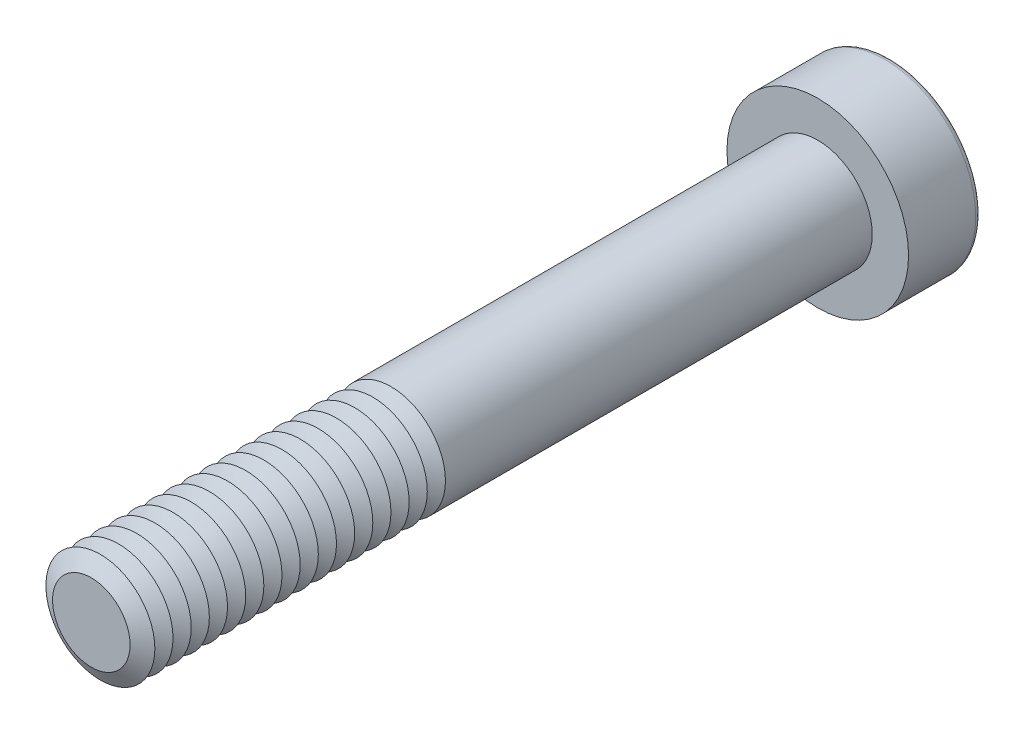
SolidWorks part; units mm, degrees
ref_plane "Front Plane" through (0, 0, 0) normal (0, 0, 1) x (1, 0, 0)
ref_plane "Top Plane" through (0, 0, 0) normal (0, 1, 0) x (1, 0, 0)
ref_plane "Right Plane" through (0, 0, 0) normal (1, 0, 0) x (0, 0, -1)
sketch "Sketch1" plane through (0, 0, 0) normal (0, 0, 1) x (1, 0, 0)
  circle A0 centre (0, 0) radius 3
  dimension "D1" = 6
extrude "Boss-Extrude1" add sketch "Sketch1" along normal blind 40
sketch "Sketch2" plane through (0, 0, 0) normal (0, 0, -1) x (-1, 0, 0)
  circle A0 centre (0, 0) radius 5
  dimension "D1" = 10
extrude "Boss-Extrude2" add sketch "Sketch2" along normal blind 4
sketch "Sketch3" plane through (0, 0, -4) normal (0, 0, -1) x (-1, 0, 0)
  line L1 (-1.1547, 2) -> (-2.3094, 0)
  line L2 (-2.3094, 0) -> (-1.1547, -2)
  line L3 (-1.1547, -2) -> (1.1547, -2)
  line L4 (1.1547, -2) -> (2.3094, 0)
  line L5 (2.3094, 0) -> (1.1547, 2)
  line L6 (1.1547, 2) -> (-1.1547, 2)
  circle A0 centre (0, 0) radius 2 construction
  dimension "D1" = 4
extrude "Cut-Extrude1" cut sketch "Sketch3" against normal blind 3
fillet "Fillet1" radius 0.3 1 edges at (-5, 0, -4)
sketch "Sketch4" plane through (0, 0, -1) normal (0, 0, -1) x (-1, 0, 0)
  line L0 (1.1547, -2) -> (2.3094, 0) construction
  circle A0 centre (0, 0) radius 2
extrude "Cut-Extrude2" cut sketch "Sketch4" against normal through all draft 60
sketch "Sketch5" plane through (0, 0, -4) normal (0, 0, -1) x (-1, 0, 0)
  circle A0 centre (0, 0) radius 2.3094
extrude "Cut-Extrude3" cut sketch "Sketch5" against normal through all draft 75
sketch "Sketch7" plane through (0, 0, 0) normal (1, 0, 0) x (0, 0, -1)
  line L25 (-40, 2.134) -> (-39.5, 3)
  line L26 (-40, 3) -> (-40, -3) construction
  line L27 (-39.5, 3) -> (-40.5, 3)
  line L28 (-40.5, 3) -> (-40, 2.134)
  line L29 (0, 3) -> (-40, 3) construction
  dimension "D1" = 1
revolve "Cut-Revolve1" cut sketch "Sketch7" angle 360 about axis through (0, 0, 40) along (0, 0, -1)
pattern_linear "LPattern1" count 17 spacing 1 along (0, 0, -1) of "Cut-Revolve1"
